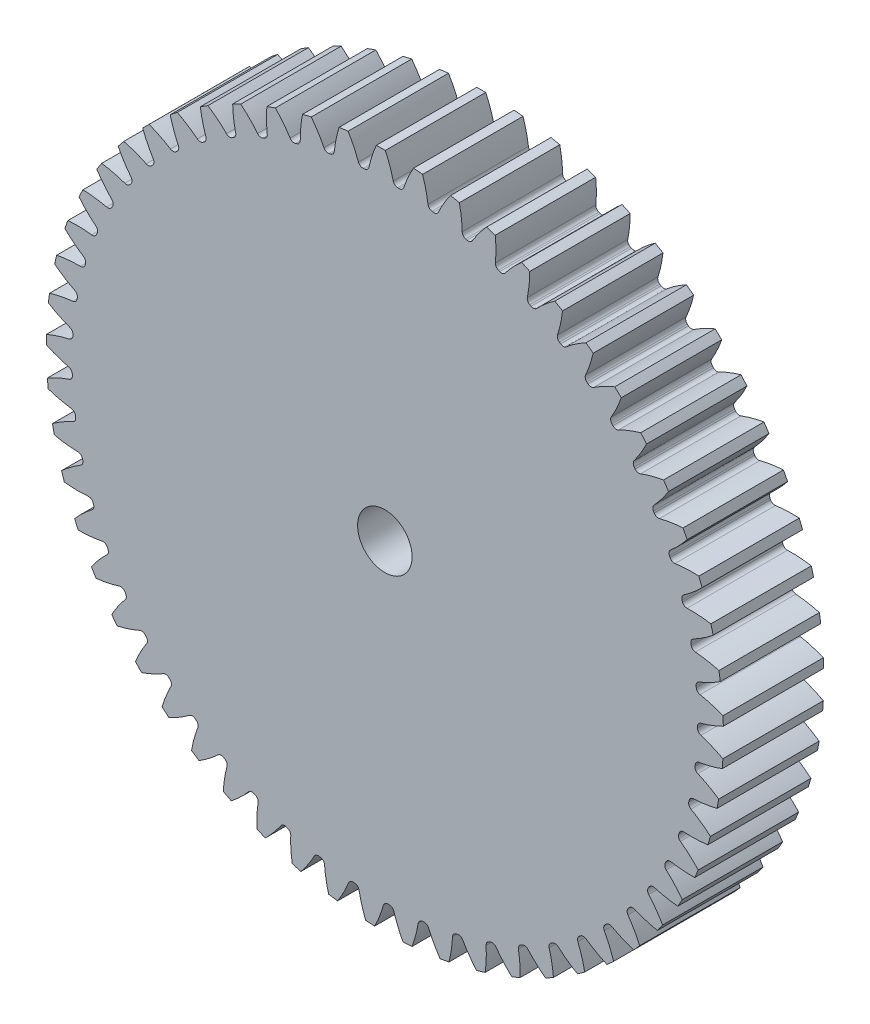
SolidWorks part; units mm, degrees
ref_plane "Front" through (0, 0, 0) normal (0, 0, 1) x (1, 0, 0)
ref_plane "Top" through (0, 0, 0) normal (0, 1, 0) x (1, 0, 0)
ref_plane "Right" through (0, 0, 0) normal (1, 0, 0) x (0, 0, -1)
sketch "Sketch3" plane through (0, 0, 0) normal (0, 0, 1) x (1, 0, 0)
  circle A0 centre (0, 0) radius 299.72
  dimension "od" = 599.44
extrude "gearBody" add sketch "Sketch3" along normal blind 88.9
sketch "Sketch2" plane through (0, 0, 0) normal (0, 0, 1) x (1, 0, 0)
  line L0 (0, 0) -> (251.3852, 104.1272) construction
  line L1 (299.3265, -17.2621) -> (0, 0) construction
  line L2 (0, 0) -> (36.3143, 0) construction
  line L3 (289.5398, 3.4186) -> (289.2911, -12.4751) construction
  line L5 (289.4155, -4.5283) -> (0, 0) construction
  line L7 (0, 0) -> (272.0974, 0) construction
  arc A0 (272.0929, -1.5572) -> (272.0085, -6.956) centre (0, 0) ccw construction
  arc A1 (299.6175, 7.8379) -> (299.2256, -17.2075) centre (0, 0) ccw construction
  arc A2 (289.5398, 3.4186) -> (289.2911, -12.4751) centre (0, 0) ccw construction
  arc A3 (276.8149, -4.9998) -> (276.8358, -3.6627) centre (0, 0) ccw
  arc A4 (299.3265, -17.2621) -> (279.7311, -9.0261) centre (248.0046, -111.9407) ccw
  arc A5 (299.3265, -17.2621) -> (299.72, 7.8893) centre (0, 0) ccw
  arc A6 (299.72, 7.8893) -> (279.8765, 0.2704) centre (251.3852, 104.1272) cw
  arc A7 (276.8358, -3.6627) -> (279.8765, 0.2704) centre (280.9705, -3.7174) cw
  arc A8 (279.7311, -9.0261) -> (276.8149, -4.9998) centre (280.9493, -5.0745) cw
  point P6 (299.72, 7.8893)
  point P22 (299.3265, -17.2621)
  dimension "baseDia" = 544.1948
  dimension "od" = 599.44
  dimension "pd" = 579.12
  dimension "rd" = 553.72
  dimension "rFillet" = 4.1351
  dimension "pointX" = 299.72
  dimension "pointY" = 7.8893
  dimension "CTT" = 15.8937
  dimension "flankCenterAngle" = 22.5
extrude "toothCut" cut sketch "Sketch2" along normal through all
pattern_circular "CirPattern1" count 57 over 360 about axis through (0, 0, 0) along (0, 0, 1) of "toothCut"
sketch "hub1Dia" plane through (0, 0, 0) normal (0, 0, -1) x (-1, 0, 0)
  circle A0 centre (0, 0) radius 12.7
  dimension "hub1Dia" = 25.4
sketch "hub2Dia" plane through (0, 0, 88.9) normal (0, 0, 1) x (1, 0, 0)
  circle A0 centre (0, 0) radius 12.7
  dimension "hub2dia" = 25.4
sketch "boreDia" plane through (0, 0, 0) normal (0, 0, 1) x (1, 0, 0)
  circle A0 centre (0, 0) radius 24.13
  dimension "boreDia" = 48.26
extrude "bore" cut sketch "boreDia" against normal mid plane 25400
